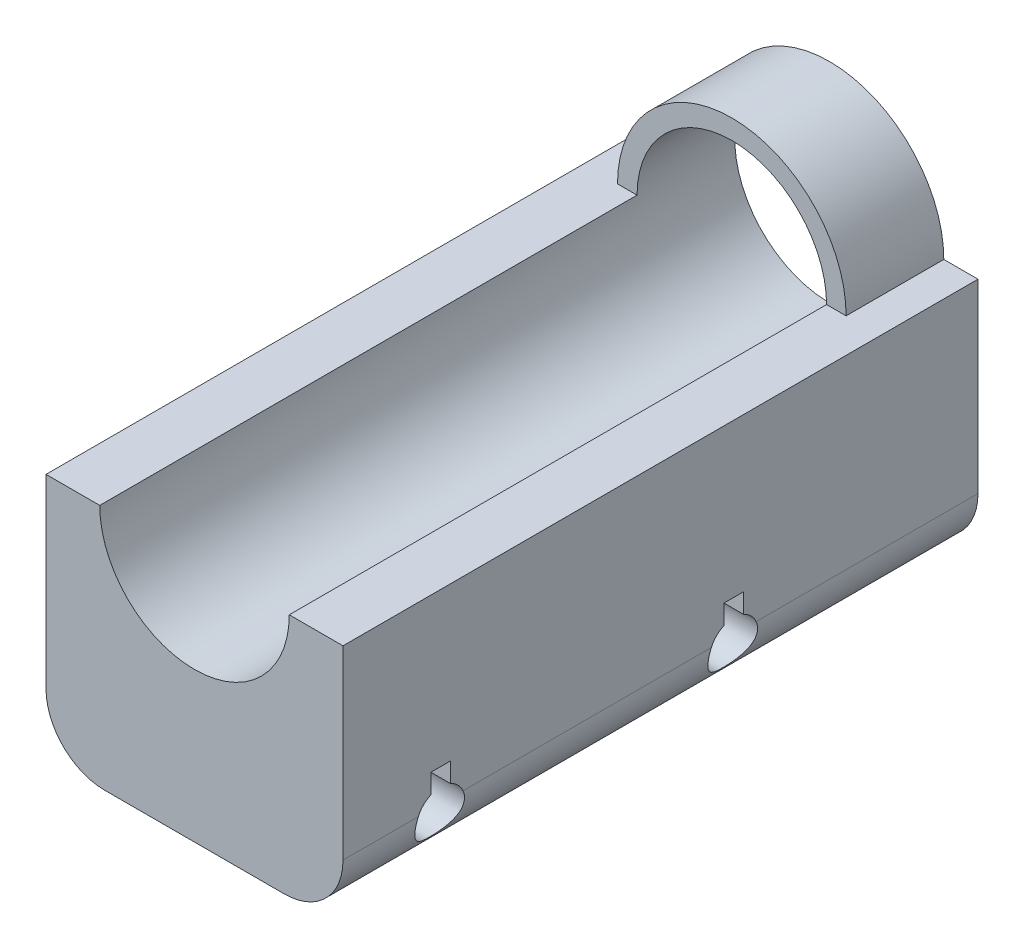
SolidWorks part; units mm, degrees
ref_plane "Front Plane" through (0, 0, 0) normal (0, 0, 1) x (1, 0, 0)
ref_plane "Top Plane" through (0, 0, 0) normal (0, 1, 0) x (1, 0, 0)
ref_plane "Right Plane" through (0, 0, 0) normal (1, 0, 0) x (0, 0, -1)
sketch "Sketch1" plane through (0, 0, 0) normal (0, 0, 1) x (1, 0, 0)
  line L0 (31.623, 31.75) -> (38.608, 31.75)
  line L1 (7.62, 0) -> (30.988, 0)
  line L2 (0, 7.62) -> (0, 31.75)
  line L3 (0, 31.75) -> (6.985, 31.75)
  line L4 (38.608, 7.62) -> (38.608, 31.75)
  arc A0 (30.988, 0) -> (38.608, 7.62) centre (30.988, 7.62) ccw
  arc A1 (7.62, 0) -> (0, 7.62) centre (7.62, 7.62) cw
  arc A2 (6.985, 31.75) -> (31.623, 31.75) centre (19.304, 31.75) ccw
  point P7 (38.608, 0)
  point P10 (0, 0)
  point P12 (19.304, 0)
  dimension "D3" = 7.62
  dimension "D4" = 24.638
  dimension "D1" = 31.75
  dimension "D2" = 38.608
extrude "Boss-Extrude1" add sketch "Sketch1" along normal blind 82.55
sketch "Sketch2" plane through (0, 0, 0) normal (0, 0, -1) x (-1, 0, 0)
  line L0 (-4.445, 31.75) -> (-6.985, 31.75)
  line L1 (-31.623, 31.75) -> (-34.163, 31.75)
  arc A0 (-6.985, 31.75) -> (-31.623, 31.75) centre (-19.304, 31.75) ccw
  arc A1 (-31.623, 31.75) -> (-6.985, 31.75) centre (-19.304, 31.75) ccw construction
  arc A2 (-4.445, 31.75) -> (-34.163, 31.75) centre (-19.304, 31.75) ccw
  circle A4 centre (-19.304, 31.75) radius 12.319 construction
  circle A5 centre (-19.304, 31.75) radius 14.859 construction
  point P1 (-3.175, 31.75)
  point P14 (-6.3088, 35.723)
  dimension "D1" = 2.54
extrude "Boss-Extrude2" add sketch "Sketch2" against normal blind 12.7
sketch "Sketch3" plane through (0, 0, 0) normal (-1, 0, 0) x (0, 0, 1)
  line L1 (82.55, 31.75) -> (0, 31.75) construction
  line L2 (30.48, 9.2599) -> (30.48, 11.7999)
  line L3 (30.48, 11.7999) -> (33.02, 11.7999)
  line L4 (33.02, 11.7999) -> (33.02, 9.2599)
  line L5 (82.55, 31.75) -> (82.55, 7.62) construction
  line L6 (71.12, 11.7999) -> (71.12, 9.2599)
  line L7 (68.58, 11.7999) -> (71.12, 11.7999)
  line L8 (68.58, 9.2599) -> (68.58, 11.7999)
  arc A0 (68.58, 9.2599) -> (71.12, 9.2599) centre (69.85, 6.35) ccw
  arc A1 (30.48, 9.2599) -> (33.02, 9.2599) centre (31.75, 6.35) ccw
  dimension "D1" = 50.8
  dimension "D2" = 6.35
  dimension "D3" = 2
  dimension "D5" = 25.4
  dimension "D7" = 2.54
  dimension "D8" = 1.27
  dimension "D9" = 2.54
extrude "Cut-Extrude1" cut sketch "Sketch3" against normal through all
